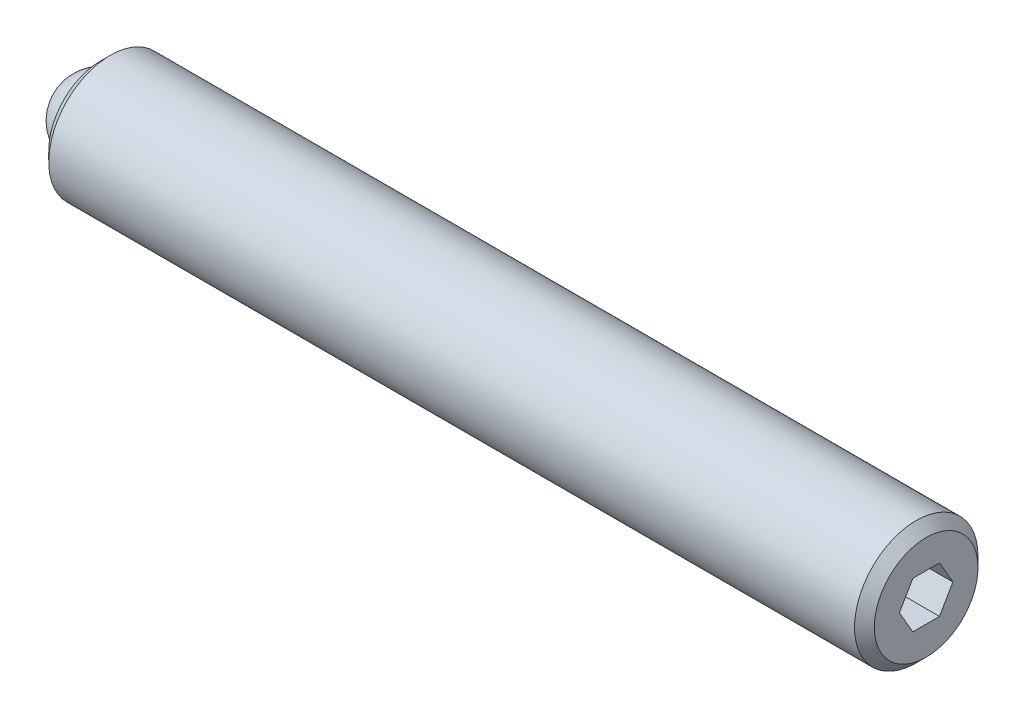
SolidWorks part; units mm, degrees
ref_plane "Front Plane" through (0, 0, 0) normal (0, 0, 1) x (1, 0, 0)
ref_plane "Top Plane" through (0, 0, 0) normal (0, 1, 0) x (1, 0, 0)
ref_plane "Right Plane" through (0, 0, 0) normal (1, 0, 0) x (0, 0, -1)
sketch "Sketch2" plane through (0, 0, 0) normal (1, 0, 0) x (0, 0, -1)
  circle A0 centre (0, 0) radius 3.175
  dimension "D1" = 6.35
extrude "Boss-Extrude1" add sketch "Sketch2" along normal blind 42.4656
sketch "Sketch3" plane through (0, 0, 0) normal (-1, 0, 0) x (0, 0, 1)
  circle A0 centre (0, 0) radius 1.9812
  dimension "D1" = 3.9624
chamfer "Chamfer1" distance 0.508 angle 45 1 edges at (0, 0, -3.175)
chamfer "Chamfer2" distance 0.508 angle 45 1 edges at (42.4656, 0, -3.175)
sketch "Sketch4" plane through (42.4656, 0, 0) normal (1, 0, 0) x (0, 0, -1)
  line L1 (1.3748, 0) -> (0.6874, 1.1906)
  line L2 (0.6874, 1.1906) -> (-0.6874, 1.1906)
  line L3 (-0.6874, 1.1906) -> (-1.3748, 0)
  line L4 (-1.3748, 0) -> (-0.6874, -1.1906)
  line L5 (-0.6874, -1.1906) -> (0.6874, -1.1906)
  line L6 (0.6874, -1.1906) -> (1.3748, 0)
  circle A0 centre (0, 0) radius 1.1906 construction
  dimension "D1" = 2.3813
extrude "Cut-Extrude2" cut sketch "Sketch4" against normal blind 2.286
extrude "Cut-Extrude3" cut sketch "Sketch3" against normal blind 1.9844
sketch "Sketch5" plane through (0, 0, 0) normal (-1, 0, 0) x (0, 0, 1)
  line L0 (0, 0) -> (0, -1.9844)
  line L1 (0, 0) -> (0, 1.9844)
  arc A0 (0, 1.9844) -> (0, -1.9844) centre (0, 0) ccw
  dimension "D1" = 1.9844
revolve "Revolve1" add sketch "Sketch5" angle 360 about L1
